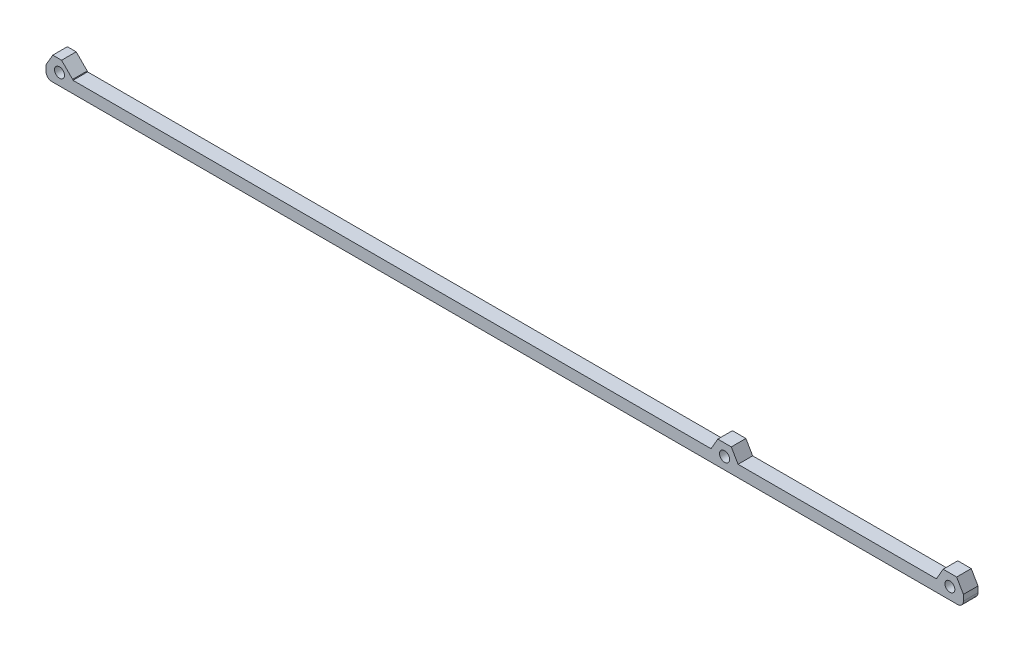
SolidWorks part; units mm, degrees
ref_plane "Front Plane" through (0, 0, 0) normal (0, 0, 1) x (1, 0, 0)
ref_plane "Top Plane" through (0, 0, 0) normal (0, 1, 0) x (1, 0, 0)
ref_plane "Right Plane" through (0, 0, 0) normal (1, 0, 0) x (0, 0, -1)
sketch "Sketch1" plane through (0, 0, 0) normal (0, 0, 1) x (1, 0, 0)
  line L0 (2.54, 0) -> (391.16, 0) construction
  line L1 (398.78, 0) -> (0, 0)
  line L2 (398.78, 0) -> (398.78, 5.08)
  line L3 (398.78, 5.08) -> (0, 5.08)
  line L4 (0, 0) -> (0, 5.08)
  line L5 (0, 22.86) -> (0, 2.54) construction
  dimension "D1" = 5.08
  dimension "D2" = 398.78
extrude "Boss-Extrude1" add sketch "Sketch1" along normal blind 6.35
fillet "Fillet1" radius 2.54 2 edges at (0, 0, 3.175) (398.78, 0, 3.175)
sketch "Sketch2" plane through (0, 0, 6.35) normal (0, 0, 1) x (1, 0, 0)
  line L0 (320.6156, 19.1685) -> (320.6156, 12.5815) construction
  line L1 (269.304, 15.875) -> (269.304, 19.2383) construction
  line L2 (269.304, 15.875) -> (320.6156, 15.875) construction
  line L3 (294.9598, 15.875) -> (294.9598, 0.3952) construction
  line L4 (398.78, 5.08) -> (0, 5.08) construction
  line L5 (297.8927, 0) -> (300.8257, 5.08)
  line L6 (300.8257, 5.08) -> (297.8927, 10.16)
  line L7 (297.8927, 10.16) -> (292.0268, 10.16)
  line L8 (292.0268, 10.16) -> (289.0939, 5.08)
  line L9 (289.0939, 5.08) -> (292.0268, 0)
  line L10 (292.0268, 0) -> (297.8927, 0)
  line L11 (398.78, 2.54) -> (398.78, 5.08) construction
  circle A0 centre (294.9598, 5.08) radius 5.08 construction
  dimension "D1" = 10.16
  dimension "D2" = 103.8202
extrude "Boss-Extrude2" add sketch "Sketch2" against normal blind 6.35
sketch "Sketch3" plane through (0, 0, 6.35) normal (0, 0, 1) x (1, 0, 0)
  line L0 (289.0939, 5.08) -> (300.8257, 5.08) construction
  circle A0 centre (294.9598, 5.08) radius 2.2
  dimension "D1" = 4.4
extrude "Cut-Extrude1" cut sketch "Sketch3" against normal through all
sketch "Sketch4" plane through (0, 0, 6.35) normal (0, 0, 1) x (1, 0, 0)
  line L0 (398.78, 5.08) -> (300.8257, 5.08) construction
  line L1 (389.9812, 0) -> (395.8471, 0)
  line L2 (395.8471, 0) -> (398.78, 5.08)
  line L3 (398.78, 5.08) -> (395.8471, 10.16)
  line L4 (395.8471, 10.16) -> (389.9812, 10.16)
  line L5 (389.9812, 10.16) -> (387.0482, 5.08)
  line L6 (387.0482, 5.08) -> (389.9812, 0)
  line L7 (398.78, 2.54) -> (398.78, 5.08) construction
  line L8 (289.0939, 5.08) -> (0, 5.08) construction
  line L9 (8.7988, 0) -> (11.7318, 5.08)
  line L10 (11.7318, 5.08) -> (8.7988, 10.16)
  line L11 (8.7988, 10.16) -> (2.9329, 10.16)
  line L12 (2.9329, 10.16) -> (0, 5.08)
  line L13 (0, 5.08) -> (2.9329, 0)
  line L14 (2.9329, 0) -> (8.7988, 0)
  line L15 (0, 5.08) -> (0, 2.54) construction
  circle A0 centre (392.9141, 5.08) radius 5.08 construction
  circle A1 centre (5.8659, 5.08) radius 5.08 construction
  dimension "D2" = 10.16
  dimension "D1" = 10.16
extrude "Boss-Extrude3" add sketch "Sketch4" against normal blind 6.35
sketch "Sketch5" plane through (0, 0, 6.35) normal (0, 0, 1) x (1, 0, 0)
  line L0 (387.0482, 5.08) -> (398.78, 5.08) construction
  line L1 (398.78, 2.54) -> (398.78, 5.08) construction
  line L2 (11.7318, 5.08) -> (0, 5.08) construction
  circle A0 centre (392.9141, 5.08) radius 2.15
  circle A1 centre (5.8659, 5.08) radius 2.15
  dimension "D1" = 4.3
  dimension "D2" = 4.3
extrude "Cut-Extrude2" cut sketch "Sketch5" against normal blind 6.35
chamfer "Chamfer1" distance 2.032 angle 45 1 edges at (8.7988, 10.16, 3.175)
